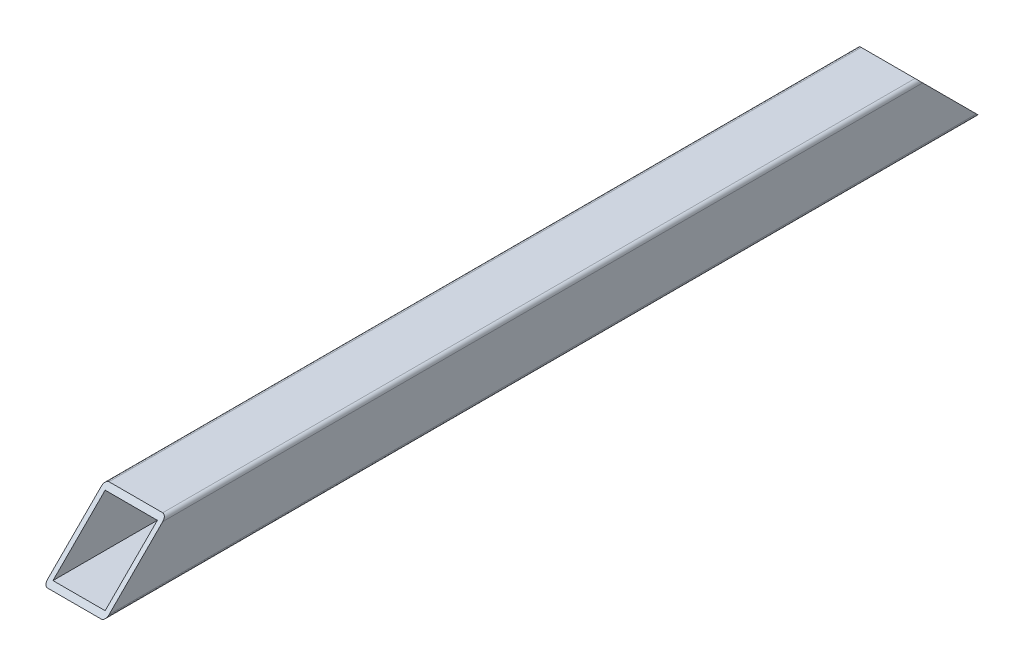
SolidWorks part; units mm, degrees
ref_plane "Plan de face" through (0, 0, 0) normal (0, 0, 1) x (1, 0, 0)
ref_plane "Plan de dessus" through (0, 0, 0) normal (0, 1, 0) x (1, 0, 0)
ref_plane "Plan de droite" through (0, 0, 0) normal (1, 0, 0) x (0, 0, -1)
sketch "Esquisse1" plane through (0, 0, 0) normal (0, 0, 1) x (1, 0, 0)
  line L1 (0, 0) -> (80, 0)
  line L2 (0, 0) -> (0, -80)
  line L3 (0, -80) -> (80, -80)
  line L4 (80, 0) -> (80, -80)
  dimension "D1" = 80
  dimension "D2" = 80
extrude "Extru.-Mince1" add sketch "Esquisse1" along normal blind 1140 thin
sketch "Esquisse2" plane through (80, 0, 0) normal (1, 0, 0) x (0, 0, -1)
  line L0 (0, -80) -> (0, 0)
  line L1 (0, 0) -> (-80, 0)
  line L2 (-1140, 0) -> (0, 0) construction
  line L3 (-80, 0) -> (0, -80)
  line L4 (-1140, -80) -> (-1060, 0)
  line L5 (-1060, 0) -> (-1140, 0)
  line L6 (-1140, 0) -> (-1140, -80)
  dimension "D1" = 80
  dimension "D2" = 80
extrude "Enlèv. mat.-Extru.1" cut sketch "Esquisse2" against normal through all
fillet "Congé1" radius 5 4 edges at (80, -80, 570) (0, -80, 570) (0, 0, 570) (80, 0, 570)
